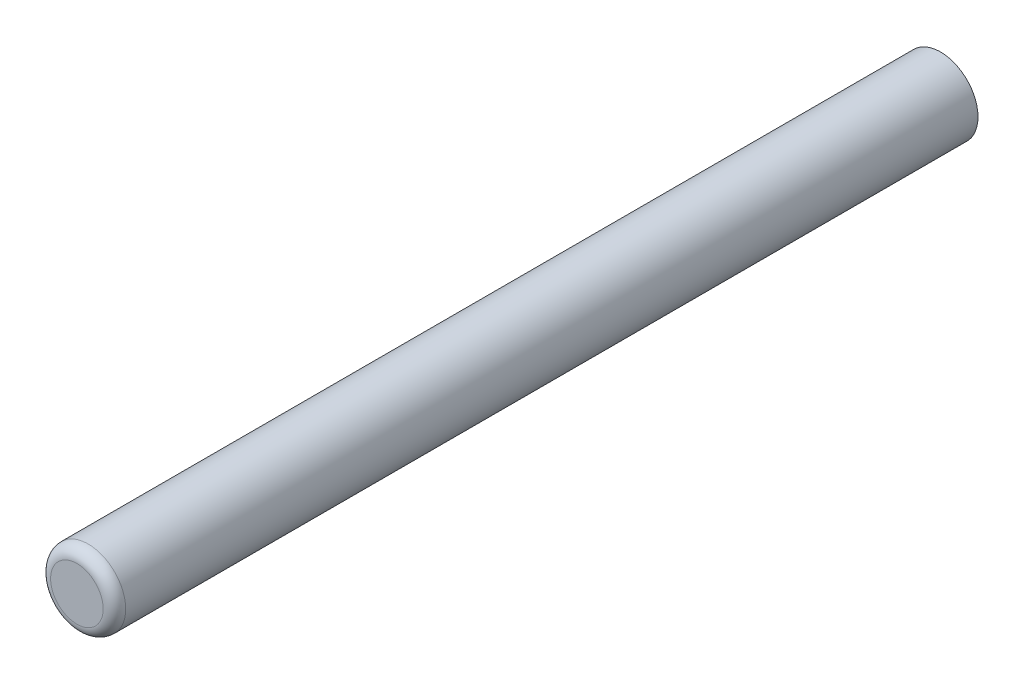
SolidWorks part; units mm, degrees
ref_plane "Plan de face" through (0, 0, 0) normal (0, 0, 1) x (1, 0, 0)
ref_plane "Plan de dessus" through (0, 0, 0) normal (0, 1, 0) x (1, 0, 0)
ref_plane "Plan de droite" through (0, 0, 0) normal (1, 0, 0) x (0, 0, -1)
sketch "Esquisse1" plane through (0, 0, 0) normal (0, 0, 1) x (1, 0, 0)
  circle A0 centre (0, 0) radius 1
  dimension "D1" = 2
extrude "Extrusion1" add sketch "Esquisse1" along normal blind 23
fillet "Congé2" radius 0.3 1 edges at (1, 0, 23)
